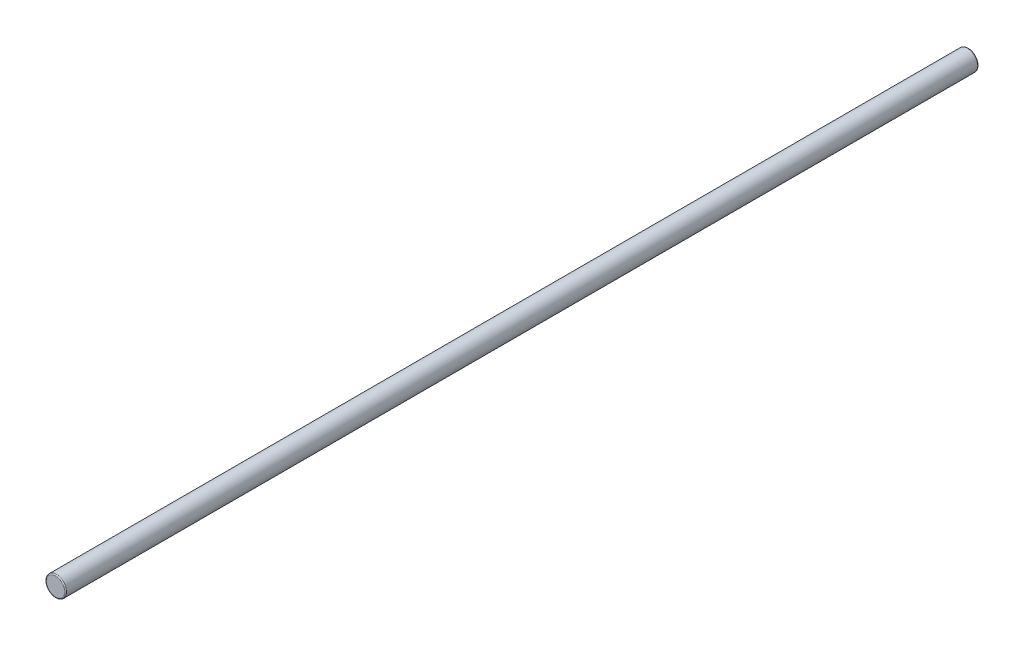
SolidWorks part; units mm, degrees
ref_plane "Plan de face" through (0, 0, 0) normal (0, 0, 1) x (1, 0, 0)
ref_plane "Plan de dessus" through (0, 0, 0) normal (0, 1, 0) x (1, 0, 0)
ref_plane "Plan de droite" through (0, 0, 0) normal (1, 0, 0) x (0, 0, -1)
sketch "Esquisse1" plane through (0, 0, 0) normal (0, 0, 1) x (1, 0, 0)
  circle A0 centre (0, 0) radius 10
  dimension "D1" = 20
extrude "Extrusion1" add sketch "Esquisse1" along normal blind 900
fillet "Congé1" radius 1 1 edges at (10, 0, 900)
fillet "Congé2" radius 1 1 edges at (10, 0, 0)
